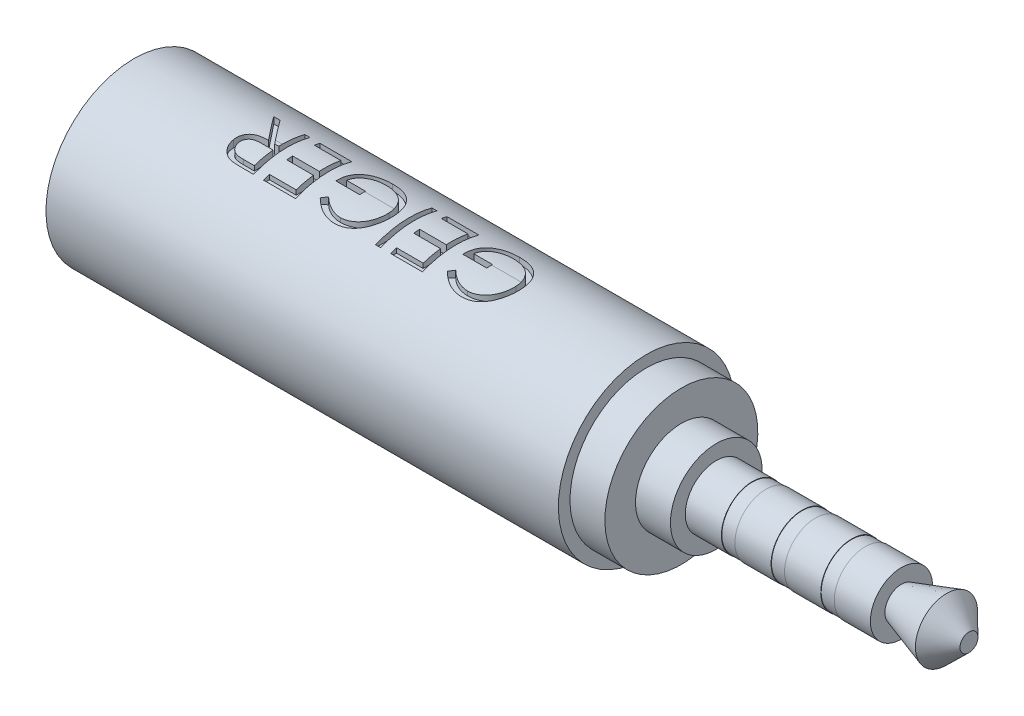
SolidWorks part; units mm, degrees
ref_plane "Front Plane" through (0, 0, 0) normal (0, 0, 1) x (1, 0, 0)
ref_plane "Top Plane" through (0, 0, 0) normal (0, 1, 0) x (1, 0, 0)
ref_plane "Right Plane" through (0, 0, 0) normal (1, 0, 0) x (0, 0, -1)
sketch "Sketch1" plane through (0, 0, 0) normal (0, 0, 1) x (1, 0, 0)
  line L0 (0, 2.5845) -> (0, 4.3117)
  line L1 (0, 4.3117) -> (-1.9685, 4.3117)
  line L2 (-1.9685, 4.3117) -> (-1.9685, 4.9657)
  line L3 (-1.9685, 4.9657) -> (-30.861, 4.9657)
  line L4 (-30.861, 4.9657) -> (-30.861, 0)
  line L5 (-30.861, 0) -> (0, 0)
  line L6 (-30.861, 0) -> (-125.6821, 0) construction
  line L7 (0, 2.5845) -> (1.9685, 2.5845)
  line L8 (1.9685, 2.5845) -> (1.9685, 1.75)
  line L9 (1.9685, 1.75) -> (4.0069, 1.75)
  line L10 (4.0069, 1.75) -> (4.0069, 1.7246)
  line L11 (4.0069, 1.7246) -> (4.7689, 1.7246)
  line L12 (4.7689, 1.7246) -> (4.7689, 1.75)
  line L13 (4.7689, 1.75) -> (6.8072, 1.75)
  line L14 (6.8072, 1.75) -> (6.8072, 1.7246)
  line L15 (6.8072, 1.7246) -> (7.5692, 1.7246)
  line L16 (7.5692, 1.7246) -> (7.5692, 1.75)
  line L17 (7.5692, 1.75) -> (9.6076, 1.75)
  line L18 (9.6076, 1.75) -> (9.6076, 1.7246)
  line L19 (9.6076, 1.7246) -> (10.3696, 1.7246)
  line L20 (10.3696, 1.7246) -> (10.3696, 1.75)
  line L21 (10.3696, 1.75) -> (12.4079, 1.75)
  line L22 (12.4079, 1.75) -> (12.4079, 0.9334)
  line L23 (12.4079, 0.9334) -> (14.9479, 1.75)
  line L24 (14.9479, 1.75) -> (16.2179, 0.508)
  line L25 (16.2179, 0.508) -> (16.2179, 0)
  line L26 (16.2179, 0) -> (0, 0)
  line L27 (12.4079, 1.75) -> (14.9479, 1.75) construction
  line L28 (0, 2.5845) -> (0, 0) construction
  dimension "D1" = 9.9314
  dimension "D2" = 28.8925
  dimension "D3" = 1.9685
  dimension "D4" = 8.6233
  dimension "D5" = 5.1689
  dimension "D6" = 3.5
  dimension "D7" = 14.2494
  dimension "D8" = 0.762
  dimension "D9" = 3.81
  dimension "D10" = 2.54
  dimension "D11" = 0.0254
  dimension "D12" = 0.8166
  dimension "D13" = 1.016
revolve "Revolve1" add sketch "Sketch1" angle 360 about L6
ref_plane "Plane1" through (0, 4.445, 0) normal (0, 1, 0) x (1, 0, 0)
sketch "Sketch2" plane through (0, 4.445, 0) normal (0, 1, 0) x (1, 0, 0)
  line L0 (-30.861, 1.27) -> (-1.9685, 1.27) construction
  line L1 (-1.9685, -4.9657) -> (-1.9685, 4.9657) construction
  line L2 (-30.861, 4.9657) -> (-30.861, -4.9657) construction
  text T0 "GEIGER"
  dimension "D1" = 1.27
extrude "Cut-Extrude1" cut sketch "Sketch2" along normal through all
